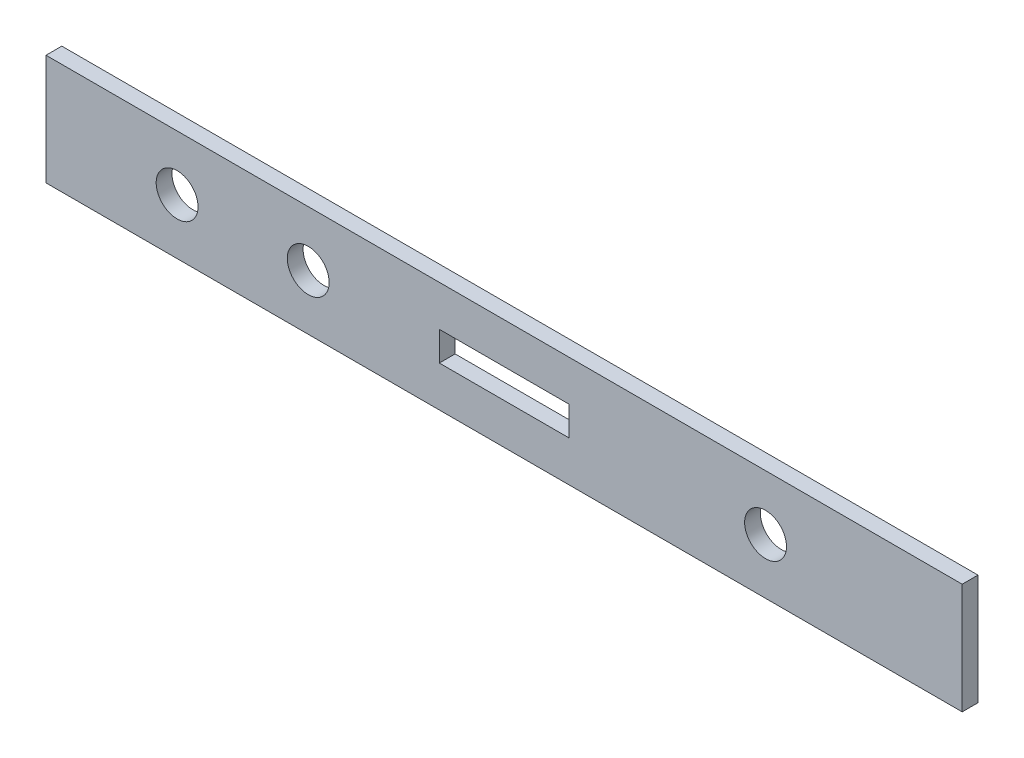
SolidWorks part; units mm, degrees
ref_plane "Plan de face" through (0, 0, 0) normal (0, 0, 1) x (1, 0, 0)
ref_plane "Plan de dessus" through (0, 0, 0) normal (0, 1, 0) x (1, 0, 0)
ref_plane "Plan de droite" through (0, 0, 0) normal (1, 0, 0) x (0, 0, -1)
sketch "Esquisse2" plane through (0, 0, 0) normal (1, 0, 0) x (0, 0, -1)
  line L12 (-162.5784, -123.6694) -> (-172.5784, -123.6694)
  line L13 (-162.5784, -123.6694) -> (-162.5784, -193.6694)
  line L14 (-162.5784, -193.6694) -> (-172.5784, -193.6694)
  line L15 (-172.5784, -123.6694) -> (-172.5784, -193.6694)
  dimension "D2" = 70
  dimension "D7" = 10
extrude "Boss.-Extru.1" add sketch "Esquisse2" along normal blind 600
sketch "Esquisse3" plane through (0, 0, 172.5784) normal (0, 0, 1) x (1, 0, 0)
  line L0 (10, -123.6694) -> (10, -193.6694)
  line L17 (0, -193.6694) -> (10, -193.6694)
  line L18 (0, -123.6694) -> (10, -123.6694)
  line L19 (0, -123.6694) -> (0, -193.6694)
  line L22 (590, -120.0649) -> (600, -120.0649)
  line L24 (590, -120.0649) -> (590, -193.6694)
  line L25 (590, -193.6694) -> (600, -193.6694)
  line L26 (600, -120.0649) -> (600, -193.6694)
  line L28 (259, -149.4194) -> (341, -149.4194)
  line L29 (259, -149.4194) -> (259, -167.9194)
  line L30 (259, -167.9194) -> (341, -167.9194)
  line L31 (341, -149.4194) -> (341, -167.9194)
  line L32 (600, -193.6694) -> (0, -193.6694) construction
  point P10 (300, -149.4194)
  point P11 (341, -158.6694)
  dimension "D1" = 70
  dimension "D2" = 10
  dimension "D3" = 10
  dimension "D4" = 300
  dimension "D5" = 18.5
  dimension "D6" = 82
  dimension "D8" = 35
extrude "Enlèv. mat.-Extru.1" cut sketch "Esquisse3" against normal blind 10
sketch "Esquisse4" plane through (0, 0, 172.5784) normal (0, 0, 1) x (1, 0, 0)
  line L2 (590, -123.6694) -> (590, -193.6694) construction
  line L3 (259, -149.4194) -> (259, -167.9194) construction
  line L4 (10, -193.6694) -> (10, -123.6694) construction
  circle A3 centre (93, -158.6694) radius 13.25
  circle A4 centre (176, -158.6694) radius 13.25
  circle A5 centre (465.5, -158.6694) radius 13.25
  point P0 (590, -149.4194)
  point P4 (341, -149.4194)
  point P6 (259, -158.6694)
  point P7 (10, -158.6694)
  dimension "D1" = 124.5
  dimension "D2" = 83
  dimension "D3" = 249
  dimension "D4" = 83
extrude "Enlèv. mat.-Extru.2" cut sketch "Esquisse4" against normal blind 10
